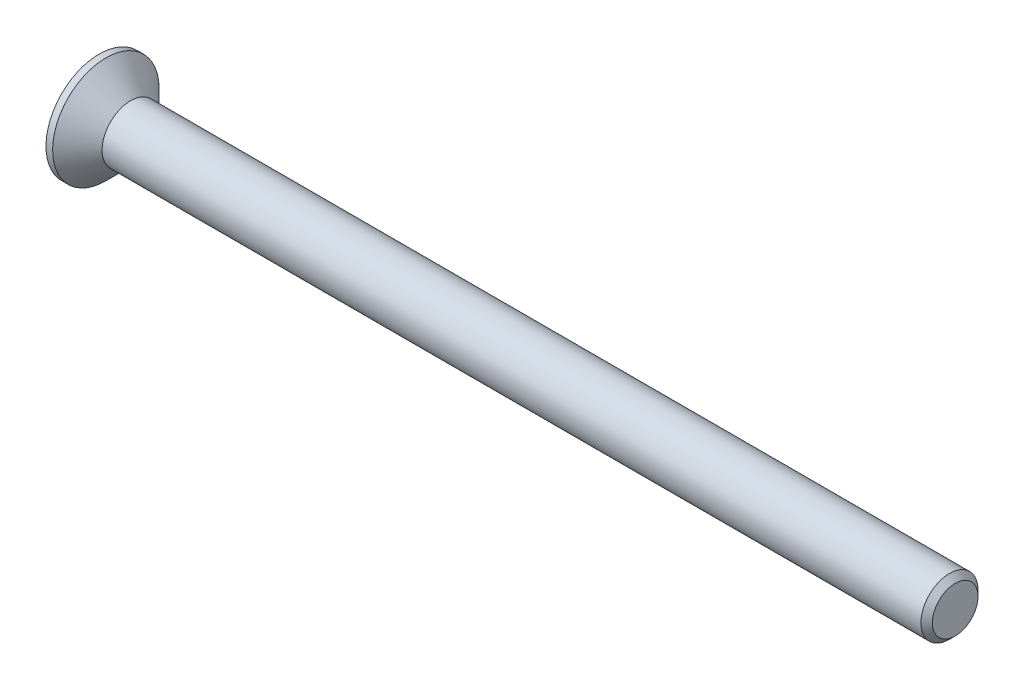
SolidWorks part; units mm, degrees
ref_plane "Front Plane" through (0, 0, 0) normal (0, 0, 1) x (1, 0, 0)
ref_plane "Top Plane" through (0, 0, 0) normal (0, 1, 0) x (1, 0, 0)
ref_plane "Right Plane" through (0, 0, 0) normal (1, 0, 0) x (0, 0, -1)
sketch "Sketch1" plane through (0, 0, 0) normal (0, 0, 1) x (1, 0, 0)
  line L1 (-1.65, 2.8) -> (-1.65, 0)
  line L2 (-1.65, 0) -> (43.35, 0)
  line L3 (43.35, 0) -> (43.35, 1.5)
  line L4 (43.35, 1.5) -> (0, 1.5)
  line L5 (-1.65, 2.8) -> (-1.3, 2.8)
  line L6 (-1.3, 2.8) -> (0, 1.5)
  dimension "D1" = 1.5
  dimension "D2" = 45
  dimension "D3" = 1.65
  dimension "D4" = 45
  dimension "D5" = 2.8
revolve "Revolve1" add sketch "Sketch1" angle 360 about L2
chamfer "Chamfer1" distance 0.3 angle 45 1 edges at (43.35, -1.5, 0)
sketch "Sketch2" plane through (-1.65, 0, 0) normal (-1, 0, 0) x (0, 0, 1)
  line L0 (-0.365, 1.45) -> (0.365, 1.45)
  line L1 (0.365, 1.45) -> (0.365, 0.365)
  line L2 (0.365, 0.365) -> (1.45, 0.365)
  line L3 (1.45, 0.365) -> (1.45, -0.365)
  line L4 (1.45, -0.365) -> (0.365, -0.365)
  line L5 (0.365, -0.365) -> (0.365, -1.45)
  line L6 (0.365, -1.45) -> (-0.365, -1.45)
  line L7 (-0.365, -1.45) -> (-0.365, -0.365)
  line L8 (-0.365, -0.365) -> (-1.45, -0.365)
  line L9 (-1.45, -0.365) -> (-1.45, 0.365)
  line L10 (-1.45, 0.365) -> (-0.365, 0.365)
  line L11 (-0.365, 0.365) -> (-0.365, 1.45)
  point P2 (0, 1.45)
  point P14 (0, -1.45)
  point P15 (1.45, 0)
  point P16 (-1.45, 0)
  dimension "D1" = 2.9
  dimension "D2" = 0.73
extrude "Cut-Extrude1" cut sketch "Sketch2" against normal blind 1.25
